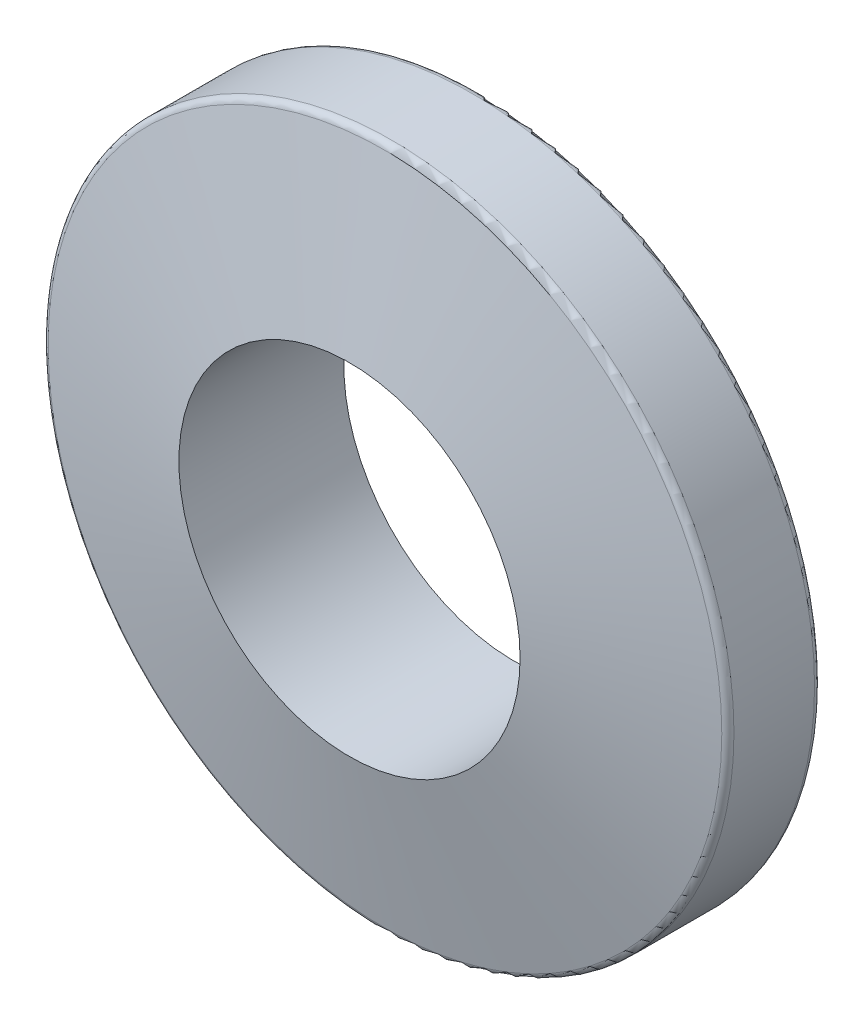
SolidWorks part; units mm, degrees
ref_plane "Front Plane" through (0, 0, 0) normal (0, 0, 1) x (1, 0, 0)
ref_plane "Top Plane" through (0, 0, 0) normal (0, 1, 0) x (1, 0, 0)
ref_plane "Right Plane" through (0, 0, 0) normal (1, 0, 0) x (0, 0, -1)
sketch "Sketch1" plane through (0, 0, 0) normal (0, 1, 0) x (1, 0, 0)
  line L0 (1.5761, 0.9732) -> (3.6721, 0.9732) construction
  line L1 (3.1623, 0.5495) -> (3.1623, 1.397)
  line L2 (3.1623, 1.397) -> (1.5761, 1.7352)
  line L3 (3.1623, 0.5495) -> (1.5761, 0.2112)
  line L4 (1.5761, 0.2112) -> (1.5761, 1.7352)
  line L5 (0, 0) -> (0, 2.4455) construction
  point P9 (3.1623, 0.9732)
  dimension "D1" = 1.5761
  dimension "D2" = 3.1623
revolve "Revolve1" add sketch "Sketch1" angle 360 about L5
fillet "Fillet1" radius 0.0635 2 edges at (3.1623, 0, -0.5495) (3.1623, 0, -1.397)
